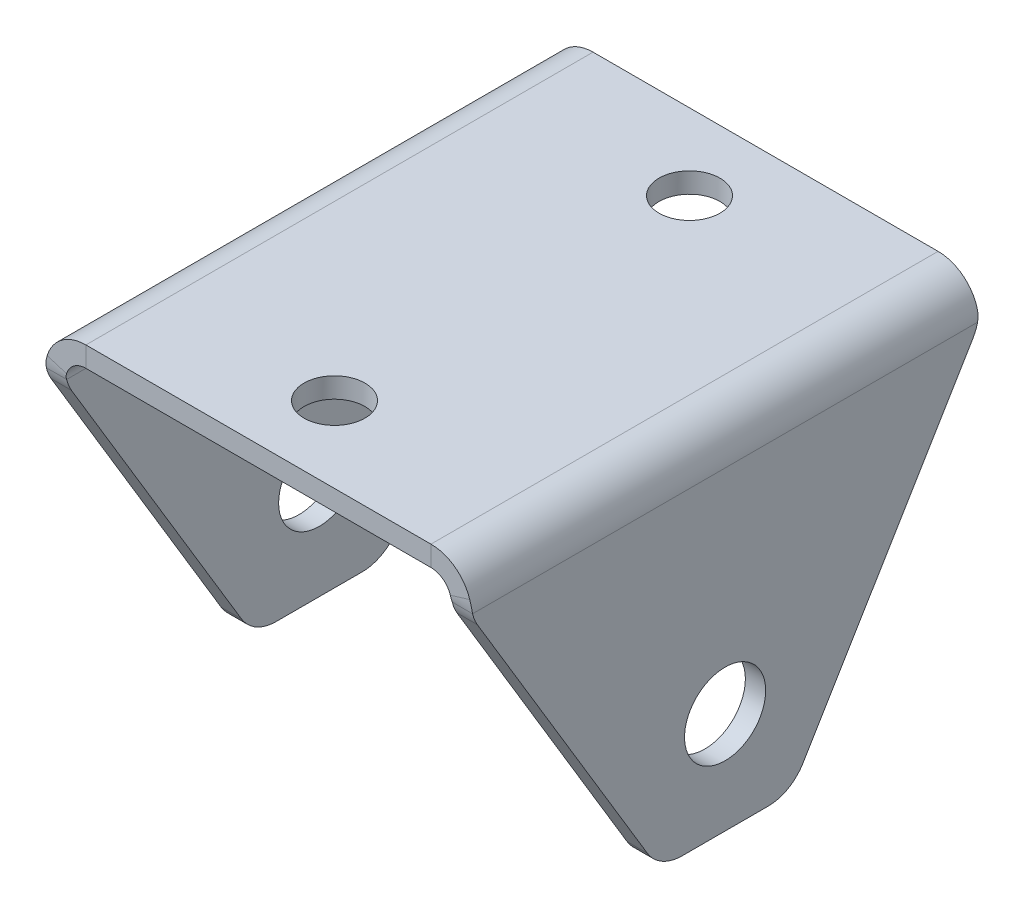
SolidWorks part; units mm, degrees
ref_plane "Plan de face" through (0, 0, 0) normal (0, 0, 1) x (1, 0, 0)
ref_plane "Plan de dessus" through (0, 0, 0) normal (0, 1, 0) x (1, 0, 0)
ref_plane "Plan de droite" through (0, 0, 0) normal (1, 0, 0) x (0, 0, -1)
sketch "Esquisse1" plane through (0, 0, 0) normal (0, 0, 1) x (1, 0, 0)
  line L0 (-53.6711, -10) -> (60.6481, -10) construction
  line L1 (0, 68.4282) -> (0, -70.388) construction
  line L2 (-21.0091, -10) -> (-19.0091, -10)
  line L3 (-19.0091, -10) -> (-19.0091, 23)
  line L4 (-19.0091, 23) -> (19.0091, 23)
  line L5 (19.0091, 23) -> (19.0091, -10)
  line L6 (19.0091, -10) -> (21.0091, -10)
  line L7 (21.0091, -10) -> (21.0091, 25)
  line L8 (21.0091, 25) -> (-21.0091, 25)
  line L9 (-21.0091, 25) -> (-21.0091, -10)
  line L10 (19.0091, -11) -> (19.0091, 11) construction
  dimension "D1" = 2
  dimension "D2" = 2
  dimension "D3" = 35
  dimension "D4" = 10
extrude "Extrusion1" add sketch "Esquisse1" along normal mid plane 50
sketch "Esquisse2" plane through (21.0091, 0, 0) normal (1, 0, 0) x (0, 0, -1)
  line L0 (-6.5, -10) -> (-25, 20.7892)
  line L1 (-25, -10) -> (25, -10) construction
  line L2 (-25, -10) -> (-25, 25) construction
  line L3 (6.5, -10) -> (25, 20.7892)
  line L4 (25, -10) -> (25, 25) construction
  line L5 (0, -5.9653) -> (0, 37.4646) construction
  line L6 (-25, 20.7892) -> (-25, -10)
  line L7 (-25, -10) -> (-6.5, -10)
  line L8 (6.5, -10) -> (25, -10)
  line L9 (25, -10) -> (25, 20.7892)
  dimension "D1" = 13
  dimension "D2" = 62
extrude "Extrusion2" cut sketch "Esquisse2" against normal through all
hole_wizard "Dégagement M81" positions "Esquisse6" profile "Esquisse7" hole size "M8" standard "ISO"
sketch "Esquisse6" plane through (21.0091, 0, 0) normal (1, 0, 0) x (0, 0, -1)
  point P0 (0, 0)
sketch "Esquisse7" plane through (21.0091, 0, 0) normal (0, 1, 0) x (0, 0, -1)
  line L0 (0, 0) -> (0, 44.4217)
  line L1 (0, 44.4217) -> (4, 42.0183)
  line L2 (4, 42.0183) -> (4, 0)
  line L5 (4, 0) -> (0, 0)
  line L10 (0, 44.4217) -> (-4, 42.0183) construction
  line L11 (0, -6.35) -> (0, 107.95) construction
  dimension "Diamètre du perçage" = 8
  dimension "Profondeur du perçage" = 42.0183
  dimension "Angle de pointe" = 118
hole_wizard "Dégagement M61" positions "Esquisse9" profile "Esquisse8" hole size "M6" standard "ISO"
sketch "Esquisse9" plane through (0, 25, 0) normal (0, 1, 0) x (-1, 0, 0)
  line L0 (0, -26.5051) -> (0, 28.71) construction
  line L1 (14.6076, 0) -> (-12.219, 0) construction
  point P1 (0, -17.5)
  point P3 (0, 17.5)
  dimension "D1" = 35
sketch "Esquisse8" plane through (0, 25, -17.5) normal (1, 0, 0) x (0, 0, 1)
  line L0 (0, 0) -> (0, 2)
  line L1 (0, 2) -> (3, 2)
  line L2 (3, 2) -> (3, 0)
  line L5 (3, 0) -> (0, 0)
  line L11 (0, -6.35) -> (0, 107.95) construction
  dimension "Diamètre du perçage jusqu'au prochain" = 6
  dimension "Profondeur du perçage jusqu'au prochain" = 2
sheet metal parameters "Tôlerie 1" parameters "D1"=2
bend "Pli dans angle2" bend angle 90 parameters "D1"=0, "D5"=1
flatten bends "Dépliage 1" parameters "D1"=0
sketch "Esquisse-Angle1" plane through (0, 25, 0) normal (0, 1, 0) x (-1, 0, 0)
  line L0 (19.3653, 25) -> (19.3653, -25) construction
  line L1 (-19.3653, -25) -> (-19.3653, 25) construction
bend "Pli dans angle1" bend angle 90 parameters "D1"=0, "D5"=2
fillet "Congé1" radius 4 8 edges at (-21.9323, 24, 25) (-52.7215, 24, -6.5) (-52.7215, 24, 6.5) (52.7215, 24, 6.5) (52.7215, 24, -6.5) (21.9323, 24, -25) (-21.9323, 24, -25) (21.9323, 24, 25)
process bends "Pliage 1" parameters "D1"=0
sketch "Esquisse-Plate1" plane through (0, 25, 0) normal (0, 1, 0) x (-1, 0, 0)
flat pattern "Etat déplié1"
sketch "Lignes de pliage1" plane through (0, 0, 0) normal (0, 1, 0) x (-1, 0, 0)
bend of the flat pattern "Dépliage-<Pli dans angle1>1"
bend of the flat pattern "Dépliage-<Pli dans angle2>1"
